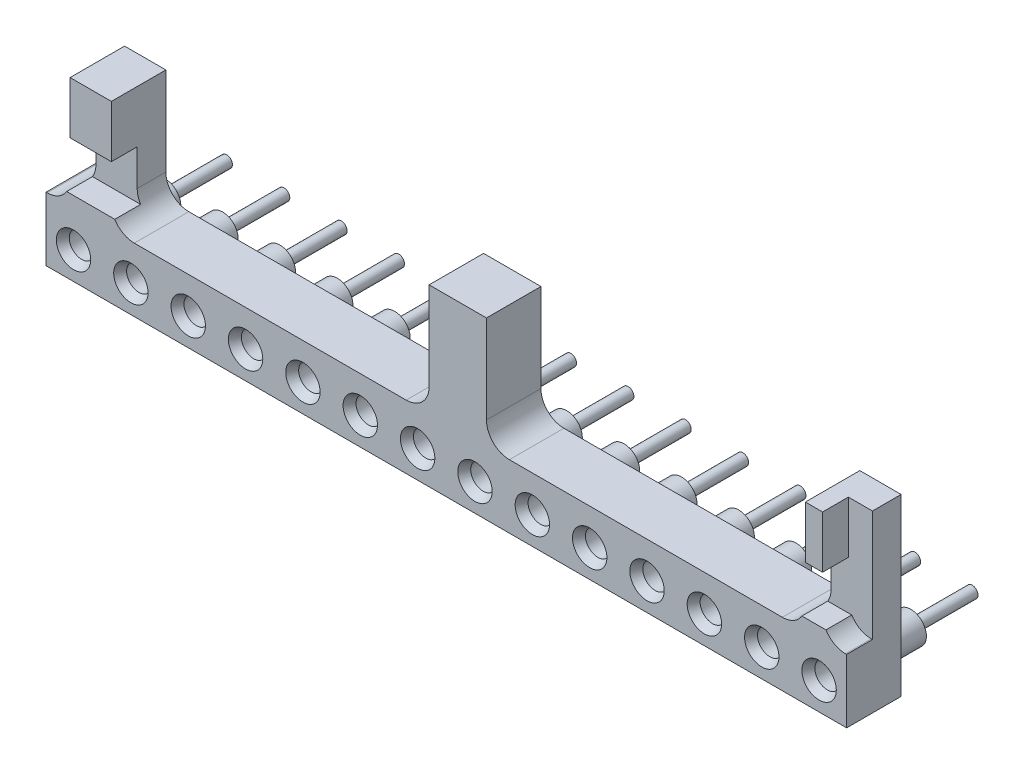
SolidWorks part; units mm, degrees
ref_plane "Front" through (0, 0, 0) normal (0, 0, 1) x (1, 0, 0)
ref_plane "Top" through (0, 0, 0) normal (0, 1, 0) x (1, 0, 0)
ref_plane "Right" through (0, 0, 0) normal (1, 0, 0) x (0, 0, -1)
imported_body "10259"
sketch "Croquis1" plane through (0, 0, 0) normal (0, 0, 1) x (1, 0, 0)
  line L1 (-19.2501, 10.4703) -> (21.4315, 10.4703)
  line L2 (-19.2501, 10.4703) -> (-19.2501, 0)
  line L3 (-19.2501, 0) -> (21.4315, 0)
  line L4 (21.4315, 10.4703) -> (21.4315, 0)
extrude "Cortar-Extruir1" cut sketch "Croquis1" against normal through all
sketch "Croquis2" plane through (0, 0, 0) normal (0, 0, 1) x (1, 0, 0)
  line L1 (19.7409, 3.2174) -> (-20.1227, 3.2174)
  line L2 (19.7409, 3.2174) -> (19.7409, -1.0907)
  line L3 (19.7409, -1.0907) -> (-20.1227, -1.0907)
  line L4 (-20.1227, 3.2174) -> (-20.1227, -1.0907)
extrude "Cortar-Extruir2" cut sketch "Croquis2" against normal blind 10
sketch "Croquis4" plane through (-17.7292, 0, 0) normal (-1, 0, 0) x (0, 0, 1)
  line L0 (-7.5619, -8.488) -> (-7.5619, -8.6313)
  line L1 (-7.5619, -8.488) -> (-9.651, -8.488)
  line L3 (-7.5619, 0.8105) -> (-9.651, 0.8105)
  line L4 (-9.651, -8.488) -> (-9.651, 0.8105)
  line L5 (-7.5619, 0.8105) -> (-6.7836, 0.8105)
  line L7 (-7.5619, -8.6313) -> (-6.7836, -8.6313)
  line L8 (-6.7836, 0.8105) -> (-6.7836, -8.6313)
extrude "Cortar-Extruir3" cut sketch "Croquis4" against normal through all
